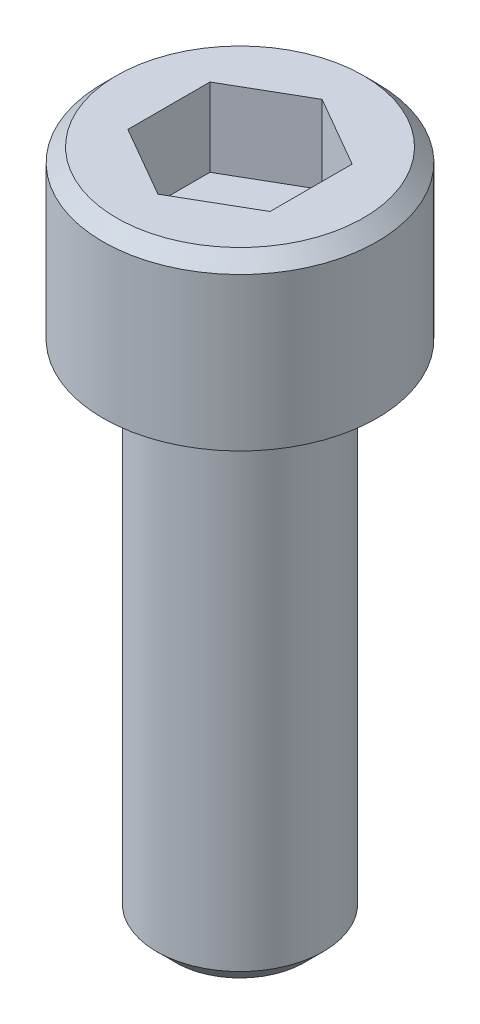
SolidWorks part; units mm, degrees
ref_plane "Front" through (0, 0, 0) normal (0, 0, 1) x (1, 0, 0)
ref_plane "Top" through (0, 0, 0) normal (0, 1, 0) x (1, 0, 0)
ref_plane "Right" through (0, 0, 0) normal (1, 0, 0) x (0, 0, -1)
sketch "Sketch1" plane through (0, 0, 0) normal (0, 0, 1) x (1, 0, 0)
  line L0 (0, 0) -> (3.429, 0)
  line L1 (3.429, 0) -> (3.429, 3.8227)
  line L2 (3.429, 3.8227) -> (3.0861, 4.1656)
  line L3 (3.0861, 4.1656) -> (0, 4.1656)
  line L4 (0, 4.1656) -> (0, 0)
  line L5 (0, 0) -> (0, 100) construction
revolve "Base-Revolve" add sketch "Sketch1" angle 360 about L5
sketch "Sketch2" plane through (0, 0, 0) normal (0, 0, 1) x (1, 0, 0)
  line L0 (0, 0) -> (0, 100) construction
  line L1 (0, -12.7) -> (1.6104, -12.7)
  line L2 (1.6104, -12.7) -> (2.0828, -12.2276)
  line L3 (2.0828, -12.2276) -> (2.0828, 0)
  line L4 (2.0828, 0) -> (0, 0)
  line L5 (0, 0) -> (0, -12.7)
revolve "Boss-Revolve1" add sketch "Sketch2" angle 360 about L0
ref_plane "Plane4" through (0, 4.1656, 0) normal (0, 1, 0) x (-1, 0, 0)
sketch "Sketch3" plane through (0, 4.1656, 0) normal (0, 1, 0) x (-1, 0, 0)
  line L0 (1.778, 1.0265) -> (0, 2.0531)
  line L1 (0, 2.0531) -> (-1.778, 1.0265)
  line L2 (-1.778, 1.0265) -> (-1.778, -1.0265)
  line L3 (-1.778, -1.0265) -> (0, -2.0531)
  line L4 (0, -2.0531) -> (1.778, -1.0265)
  line L5 (1.778, -1.0265) -> (1.778, 1.0265)
extrude "Cut-Extrude1" cut sketch "Sketch3" against normal blind 1.9558
